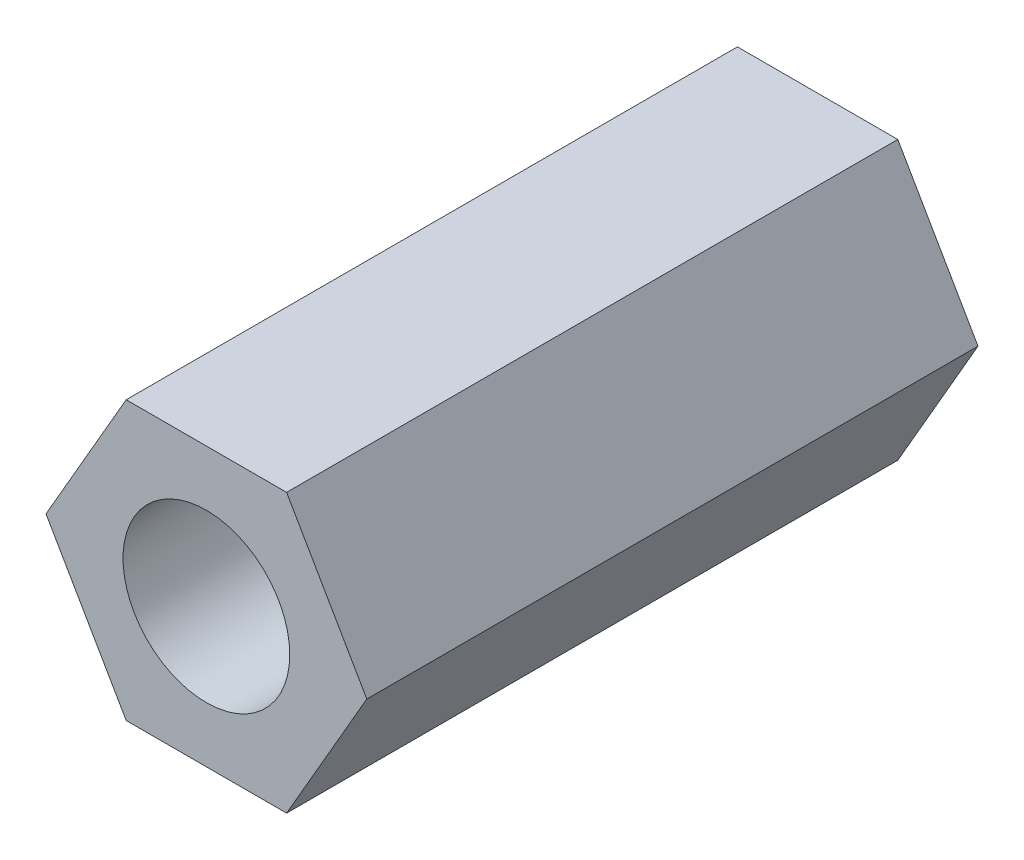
SolidWorks part; units mm, degrees
ref_plane "Face" through (0, 0, 0) normal (0, 0, 1) x (1, 0, 0)
ref_plane "Dessus" through (0, 0, 0) normal (0, 1, 0) x (1, 0, 0)
ref_plane "Droite" through (0, 0, 0) normal (1, 0, 0) x (0, 0, -1)
sketch "Esquisse1" plane through (0, 0, 0) normal (0, 0, 1) x (1, 0, 0)
  line L1 (2.8868, 0) -> (1.4434, 2.5)
  line L2 (1.4434, 2.5) -> (-1.4434, 2.5)
  line L3 (-1.4434, 2.5) -> (-2.8868, 0)
  line L4 (-2.8868, 0) -> (-1.4434, -2.5)
  line L5 (-1.4434, -2.5) -> (1.4434, -2.5)
  line L6 (1.4434, -2.5) -> (2.8868, 0)
  circle A0 centre (0, 0) radius 2.5 construction
  circle A1 centre (0, 0) radius 1.25
  dimension "D2" = 2.5
  dimension "D1" = 5
extrude "Extrusion1" add sketch "Esquisse1" along normal blind 11
sketch "Esquisse2" plane through (0, 0, 11) normal (0, 0, 1) x (1, 0, 0)
  circle A0 centre (0, 0) radius 1.5
  dimension "D1" = 3
extrude "Enlèv. mat.-Extru.1" cut sketch "Esquisse2" against normal blind 4
